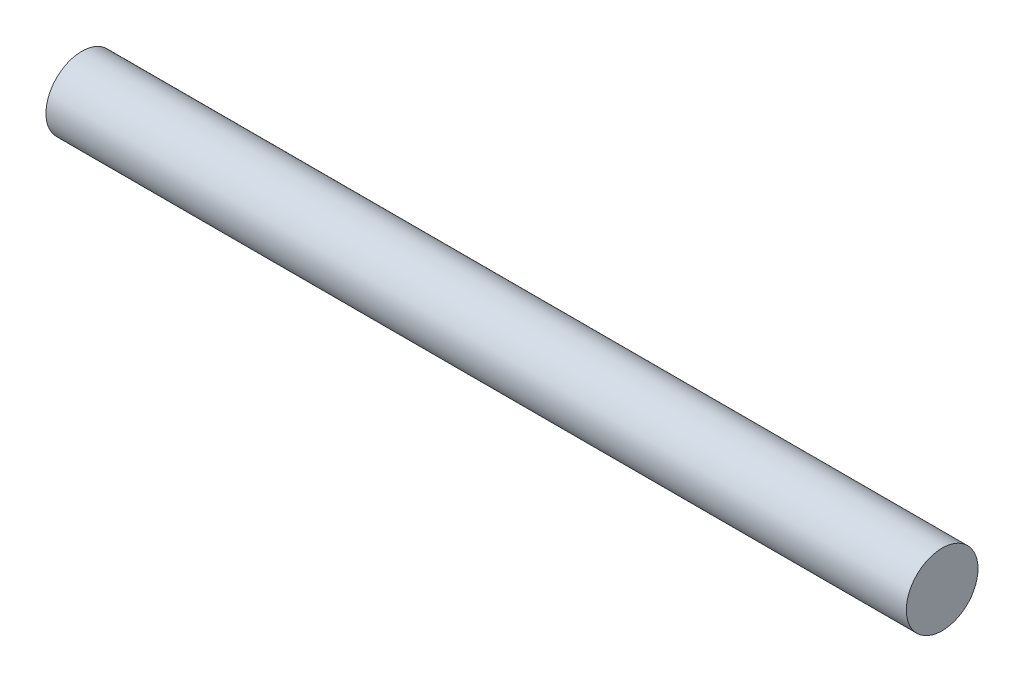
SolidWorks part; units mm, degrees
ref_plane "Front Plane" through (0, 0, 0) normal (0, 0, 1) x (1, 0, 0)
ref_plane "Top Plane" through (0, 0, 0) normal (0, 1, 0) x (1, 0, 0)
ref_plane "Right Plane" through (0, 0, 0) normal (1, 0, 0) x (0, 0, -1)
sketch "Sketch1" plane through (0, 0, 0) normal (1, 0, 0) x (0, 0, -1)
  circle A0 centre (0, 0) radius 5
  dimension "D1" = 10
extrude "Boss-Extrude1" add sketch "Sketch1" along normal blind 120
